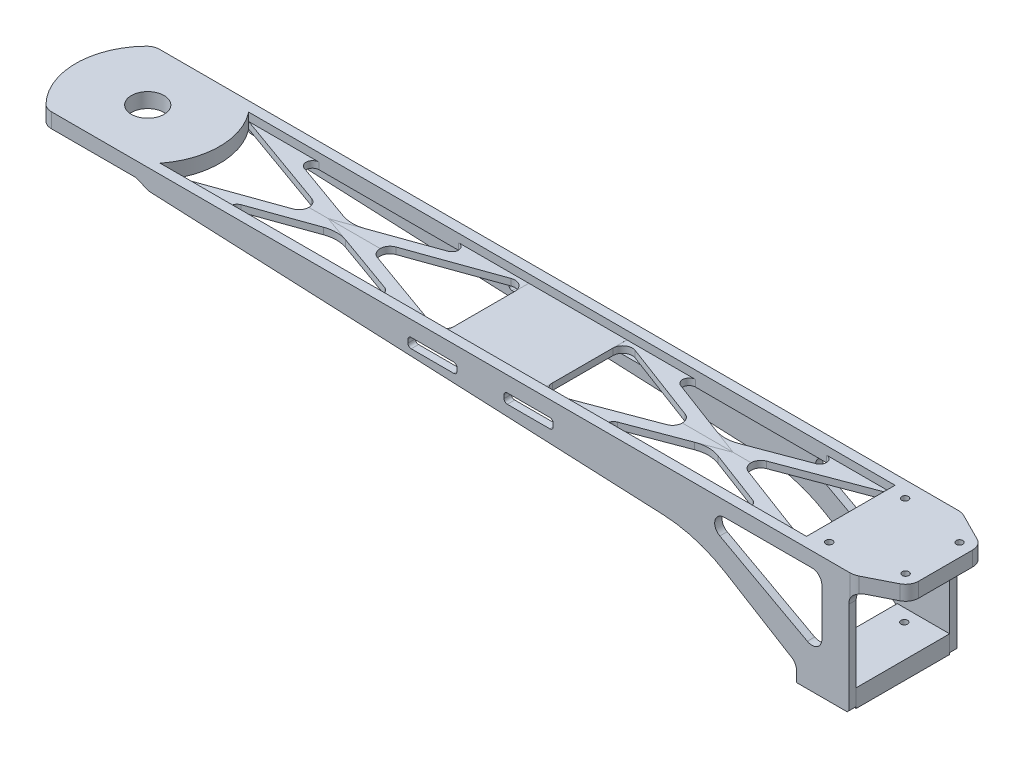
SolidWorks part; units mm, degrees
ref_plane "Front Plane" through (0, 0, 0) normal (0, 0, 1) x (1, 0, 0)
ref_plane "Top Plane" through (0, 0, 0) normal (0, 1, 0) x (1, 0, 0)
ref_plane "Right Plane" through (0, 0, 0) normal (1, 0, 0) x (0, 0, -1)
ref_plane "Plane1" through (0, 143.7668, 0) normal (0, -1, 0) x (-1, 0, 0)
sketch "Sketch6" plane through (0, 143.7668, 0) normal (0, -1, 0) x (-1, 0, 0)
  line L0 (-145.7224, -241.2305) -> (-129.7224, -241.2305)
  line L1 (-129.7224, -241.2305) -> (-129.7224, -212.6555)
  line L2 (-129.7224, -212.6555) -> (-145.7224, -212.6555)
  line L3 (-145.7224, -212.6555) -> (-145.7224, -241.2305)
  circle A0 centre (-135.7224, -237.368) radius 1.025
  circle A1 centre (-135.7224, -216.518) radius 1.025
  dimension "D1" = 16
  dimension "D2" = 28.575
  dimension "D3" = 10
  dimension "D4" = 10
extrude "Boss-Extrude2" add sketch "Sketch6" against normal blind 5.5 separate body
imported_body "Imported4"
sketch "Sketch7" plane through (0, 143.7668, 0) normal (0, -1, 0) x (1, 0, 0)
  line L0 (147.2924, 213.4055) -> (147.2924, 240.4805)
  line L1 (147.2924, 240.4805) -> (129.7924, 240.4805)
  line L2 (129.7924, 240.4805) -> (129.7924, 213.4055)
  line L3 (129.7924, 213.4055) -> (147.2924, 213.4055)
extrude "Cut-Extrude2" cut sketch "Sketch7" against normal blind 32.7375
sketch "Sketch8" plane through (147.2924, 0, 0) normal (1, 0, 0) x (0, 0, -1)
  line L0 (-210.4055, 176.5043) -> (-243.4805, 176.5043)
  line L1 (-243.4805, 176.5043) -> (-243.4805, 181.0168)
  line L2 (-243.4805, 181.0168) -> (-210.4055, 181.0168)
  line L3 (-210.4055, 181.0168) -> (-210.4055, 176.5043)
extrude "Boss-Extrude3" add sketch "Sketch8" along normal blind 11.5
chamfer "Chamfer2" distance 11.5 angle 26.886 2 edges at (158.7924, 178.7606, 210.4055) (158.7924, 178.7606, 243.4805)
sketch "Sketch9" plane through (0, 143.7668, 0) normal (0, -1, 0) x (1, 0, 0)
  line L0 (51.8572, 238.955) -> (76.3305, 229.751)
  line L1 (76.3305, 224.135) -> (51.8572, 214.9309)
  line L2 (47.8011, 217.7389) -> (47.8011, 236.1471)
  line L3 (13.7904, 214.8406) -> (-12.1384, 224.1183)
  line L4 (-12.1384, 229.7676) -> (13.7904, 239.0454)
  line L5 (17.8011, 236.2207) -> (17.8011, 217.6652)
  line L6 (88.7968, 225.0625) -> (119.7924, 213.4055)
  line L7 (119.7924, 213.4055) -> (129.7924, 213.4055)
  line L8 (129.7924, 213.4055) -> (101.2631, 224.135)
  line L9 (101.2631, 229.751) -> (129.7924, 240.4805)
  line L10 (129.7924, 240.4805) -> (119.7924, 240.4805)
  line L11 (119.7924, 240.4805) -> (88.7968, 228.8234)
  line L12 (88.7968, 228.8234) -> (57.8011, 240.4805)
  line L13 (57.8011, 240.4805) -> (7.8011, 240.4805)
  line L14 (7.8011, 240.4805) -> (-25.0324, 228.7321)
  line L15 (-25.0324, 228.7321) -> (-57.8659, 240.4805)
  line L16 (-57.8659, 240.4805) -> (-67.8659, 240.4805)
  line L17 (-67.8659, 240.4805) -> (-37.9264, 229.7676)
  line L18 (-37.9264, 224.1183) -> (-67.8659, 213.4055)
  line L19 (-67.8659, 213.4055) -> (-57.8659, 213.4055)
  line L20 (-57.8659, 213.4055) -> (-25.0324, 225.1539)
  line L21 (-25.0324, 225.1539) -> (7.8011, 213.4055)
  line L22 (7.8011, 213.4055) -> (57.8011, 213.4055)
  line L23 (57.8011, 213.4055) -> (88.7968, 225.0625)
  arc A0 (47.8011, 236.1471) -> (51.8572, 238.955) centre (50.8011, 236.1471) cw
  arc A1 (76.3305, 229.751) -> (76.3305, 224.135) centre (75.2744, 226.943) cw
  arc A2 (51.8572, 214.9309) -> (47.8011, 217.7389) centre (50.8011, 217.7389) cw
  arc A3 (17.8011, 217.6652) -> (13.7904, 214.8406) centre (14.8011, 217.6652) cw
  arc A4 (-12.1384, 224.1183) -> (-12.1384, 229.7676) centre (-11.1277, 226.943) cw
  arc A5 (13.7904, 239.0454) -> (17.8011, 236.2207) centre (14.8011, 236.2207) cw
  arc A6 (101.2631, 224.135) -> (101.2631, 229.751) centre (102.3191, 226.943) cw
  arc A7 (-37.9264, 229.7676) -> (-37.9264, 224.1183) centre (-38.9371, 226.943) cw
extrude "Cut-Extrude3" cut sketch "Sketch9" against normal blind 32.7375
sketch "Sketch10" plane through (0, 0, 213.4055) normal (0, 0, 1) x (1, 0, 0)
  line L0 (129.7224, 143.7668) -> (147.2924, 143.7668)
  line L1 (147.2924, 143.7668) -> (147.2924, 176.5043)
  line L2 (147.2924, 176.5043) -> (-82.2076, 176.5043)
  line L3 (-82.2076, 176.5043) -> (129.7224, 143.7668)
extrude "Cut-Extrude4" cut sketch "Sketch10" against normal blind 0.75
sketch "Sketch11" plane through (147.2924, 0, 0) normal (1, 0, 0) x (0, 0, -1)
  line L0 (-243.4805, 143.7668) -> (-240.4805, 143.7668)
  line L1 (-240.4805, 143.7668) -> (-240.4805, 176.5043)
  line L2 (-240.4805, 176.5043) -> (-243.4805, 176.5043)
  line L3 (-243.4805, 176.5043) -> (-243.4805, 143.7668)
extrude "Cut-Extrude5" cut sketch "Sketch11" against normal blind 1.57
sketch "Sketch12" plane through (0, 0, 240.4805) normal (0, 0, -1) x (-1, 0, 0)
  line L0 (-145.7224, 176.5043) -> (-145.7224, 143.7668)
  line L1 (-145.7224, 143.7668) -> (-129.7224, 143.7668)
  line L2 (-129.7224, 143.7668) -> (82.2076, 176.5043)
  line L3 (82.2076, 176.5043) -> (-145.7224, 176.5043)
extrude "Cut-Extrude6" cut sketch "Sketch12" against normal blind 0.75
sketch "Sketch13" plane through (147.2924, 0, 0) normal (1, 0, 0) x (0, 0, -1)
  line L0 (-210.4055, 143.7668) -> (-210.4055, 176.5043)
  line L1 (-210.4055, 176.5043) -> (-212.6555, 176.5043)
  line L2 (-212.6555, 176.5043) -> (-212.6555, 143.7668)
  line L3 (-212.6555, 143.7668) -> (-210.4055, 143.7668)
extrude "Cut-Extrude7" cut sketch "Sketch13" against normal blind 1.57
hole_wizard "Ø2.05 (2.05) Diameter Hole1" positions "Sketch15" profile "Sketch14" hole size "Ø2.05" standard "ANSI Metric"
sketch "Sketch15" plane through (0, 181.0168, 0) normal (0, 1, 0) x (1, 0, 0)
  point P0 (134.7924, -238.543)
  point P1 (154.7924, -235.193)
  point P2 (154.7924, -218.693)
  point P3 (134.7924, -215.343)
sketch "Sketch14" plane through (134.7924, 181.0168, 238.543) normal (1, 0, 0) x (0, 0, 1)
  line L0 (0, 0) -> (0, 15)
  line L1 (0, 15) -> (1.025, 15)
  line L2 (1.025, 15) -> (1.025, 0)
  line L5 (1.025, 0) -> (0, 0)
  line L10 (0, 15) -> (-1.025, 15) construction
  line L11 (0, -6.35) -> (0, 107.95) construction
  dimension "Hole Dia." = 2.05
  dimension "Hole Depth" = 15
  dimension "Drill Angle" = 180
hole_wizard "Ø10.0 (10) Diameter Hole1" positions "Sketch17" profile "Sketch16" hole size "Ø10.0" standard "ANSI Metric"
sketch "Sketch17" plane through (0, 181.0168, 0) normal (0, 1, 0) x (1, 0, 0)
  point P0 (-85.2076, -226.943)
sketch "Sketch16" plane through (-85.2076, 181.0168, 226.943) normal (1, 0, 0) x (0, 0, 1)
  line L0 (0, 0) -> (0, 37.25)
  line L1 (0, 37.25) -> (5, 37.25)
  line L2 (5, 37.25) -> (5, 0)
  line L5 (5, 0) -> (0, 0)
  line L10 (0, 37.25) -> (-5, 37.25) construction
  line L11 (0, -6.35) -> (0, 107.95) construction
  dimension "Hole Dia." = 10
  dimension "Hole Depth" = 37.25
  dimension "Drill Angle" = 180
chamfer "Chamfer3" distance 0.5 angle 45 2 edges at (145.7224, 143.7668, 211.5305) (145.7224, 143.7668, 242.3555)
fillet "Fillet1" radius 4 6 edges at (158.7924, 178.7606, 237.6496) (158.7924, 178.7606, 216.2363) (145.7224, 176.5043, 242.3555) (145.7224, 176.5043, 211.5305) (-99.7166, 178.7606, 210.4055) (-99.7166, 178.7606, 243.4805)
fillet "Fillet2" radius 5 2 edges at (147.2924, 178.3492, 210.4055) (147.2924, 178.3492, 243.4805)
fillet "Fillet3" radius 10 4 edges at (88.7968, 177.5099, 228.8234) (-25.0324, 177.5099, 228.7321) (88.7968, 177.5099, 225.0625) (-25.0324, 177.5099, 225.1539)
sketch "Sketch18" plane through (0, 0, 210.4055) normal (0, 0, -1) x (-1, 0, 0)
  line L0 (-129.7224, 143.7668) -> (-129.7224, 148.7912)
  line L1 (-129.7224, 148.7912) -> (-99.2371, 167.3921)
  line L2 (-99.2371, 167.3921) -> (68.4295, 174.8799)
  line L3 (72.1131, 174.945) -> (-129.7224, 143.7668)
  line L4 (72.1131, 174.945) -> (82.2076, 176.5043)
  line L5 (82.2076, 176.5043) -> (72.1131, 176.5043)
  line L6 (72.1131, 176.5043) -> (68.4295, 174.8799)
  line L7 (-137.4737, 176.5043) -> (-137.4737, 153.9626)
  line L8 (-137.4737, 153.9626) -> (-95.8731, 176.5043)
  line L9 (-95.8731, 176.5043) -> (-137.4737, 176.5043)
  line L10 (-40.297, 173.2555) -> (-55.297, 173.2555)
  line L11 (-40.297, 173.2555) -> (-40.297, 176.2555)
  line L12 (-40.297, 176.2555) -> (-55.297, 176.2555)
  line L13 (-55.297, 173.2555) -> (-55.297, 176.2555)
  line L14 (-25.9016, 173.2555) -> (-10.9016, 173.2555)
  line L15 (-25.9016, 173.2555) -> (-25.9016, 176.2555)
  line L16 (-25.9016, 176.2555) -> (-10.9016, 176.2555)
  line L17 (-10.9016, 173.2555) -> (-10.9016, 176.2555)
extrude "Cut-Extrude8" cut sketch "Sketch18" against normal blind 40
fillet "Fillet4" radius 3 2 edges at (129.7224, 148.7912, 242.3555) (129.7224, 148.7912, 211.5305)
fillet "Fillet5" radius 40 2 edges at (99.2371, 167.3921, 242.3555) (99.2371, 167.3921, 211.5305)
fillet "Fillet6" radius 3 4 edges at (-72.1131, 176.5043, 242.3555) (-72.1131, 176.5043, 211.5305) (-68.4295, 174.8799, 211.5305) (-68.4295, 174.8799, 242.3555)
fillet "Fillet7" radius 3 6 edges at (137.4737, 153.9626, 242.3555) (137.4737, 153.9626, 211.5305) (137.4737, 176.5043, 242.3555) (95.8731, 176.5043, 242.3555) (95.8731, 176.5043, 211.5305) (137.4737, 176.5043, 211.5305)
fillet "Fillet8" radius 1 16 edges at (25.9016, 176.2555, 242.3555) (10.9016, 176.2555, 242.3555) (10.9016, 173.2555, 242.3555) (25.9016, 173.2555, 242.3555) (55.297, 173.2555, 242.3555) (40.297, 176.2555, 242.3555) (40.297, 173.2555, 242.3555) (55.297, 176.2555, 242.3555) (25.9016, 176.2555, 211.5305) (10.9016, 173.2555, 211.5305) (10.9016, 176.2555, 211.5305) (25.9016, 173.2555, 211.5305) (55.297, 173.2555, 211.5305) (40.297, 173.2555, 211.5305) (40.297, 176.2555, 211.5305) (55.297, 176.2555, 211.5305)
fillet "Fillet9" radius 2 16 edges
